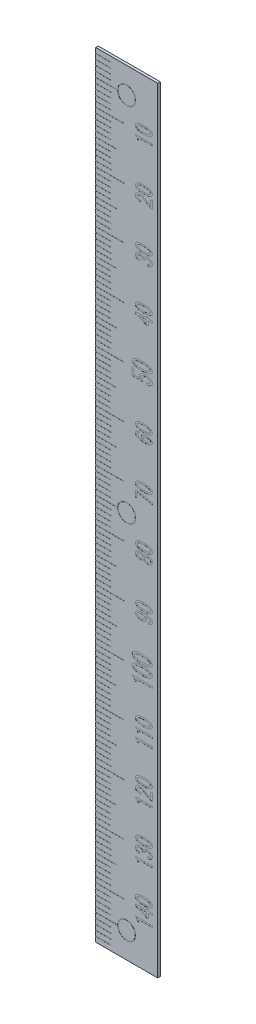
SolidWorks part; units mm, degrees
ref_plane "Front" through (0, 0, 0) normal (0, 0, 1) x (1, 0, 0)
ref_plane "Top" through (0, 0, 0) normal (0, 1, 0) x (1, 0, 0)
ref_plane "Right" through (0, 0, 0) normal (1, 0, 0) x (0, 0, -1)
sketch "Sketch1" plane through (0, 0, 0) normal (0, 0, 1) x (1, 0, 0)
  line L1 (0, 0) -> (0, 150)
  line L2 (0, 0) -> (12, 0)
  line L3 (12, 0) -> (12, 150)
  line L4 (0, 150) -> (12, 150)
  dimension "D1" = 150
  dimension "D2" = 12
extrude "Extrude1" add sketch "Sketch1" along normal blind 0.5
sketch "Sketch2" plane through (0, 0, 0.5) normal (0, 0, 1) x (1, 0, 0)
  line L0 (0, 150) -> (0, 0) construction
  line L1 (0, 0) -> (12, 0) construction
  line L2 (12, 150) -> (0, 150) construction
  circle A0 centre (6, 5) radius 1.75
  circle A1 centre (6, 145) radius 1.75
  circle A2 centre (6, 5) radius 1.65
  circle A3 centre (6, 145) radius 1.65
  circle A4 centre (6, 75) radius 1.75
  circle A5 centre (6, 75) radius 1.65
  dimension "D1" = 6
  dimension "D2" = 6
  dimension "D3" = 5
  dimension "D4" = 5
  dimension "D5" = 3.5
  dimension "D6" = 3.5
  dimension "D7" = 0.1
  dimension "D8" = 2
extrude "Extrude2" cut sketch "Sketch2" against normal blind 0.01
sketch "Sketch3" plane through (0, 0, 0.5) normal (0, 0, 1) x (1, 0, 0)
  line L0 (12, 150) -> (0, 150) construction
  line L1 (7.5, 138.25) -> (11, 138.25) construction
  line L2 (7.5, 138.25) -> (7.5, 141.75) construction
  line L3 (7.5, 141.75) -> (11, 141.75) construction
  line L4 (11, 138.25) -> (11, 141.75) construction
  line L6 (11, 128.25) -> (11, 131.75) construction
  line L7 (11, 118.25) -> (11, 121.75) construction
  line L8 (11, 108.25) -> (11, 111.75) construction
  line L9 (11, 98.25) -> (11, 101.75) construction
  line L10 (11, 88.25) -> (11, 91.75) construction
  line L11 (11, 78.25) -> (11, 81.75) construction
  line L12 (11, 68.25) -> (11, 71.75) construction
  line L13 (11, 58.25) -> (11, 61.75) construction
  line L14 (11, 47.2) -> (11, 52.8) construction
  line L15 (11, 37.2) -> (11, 42.8) construction
  line L16 (11, 48.25) -> (11, 51.75) construction
  line L17 (11, 50) -> (-4.9003, 50) construction
  line L18 (11, 27.2) -> (11, 32.8) construction
  line L19 (11, 17.2) -> (11, 22.8) construction
  line L20 (11, 7.2) -> (11, 12.8) construction
  line L21 (12, 0) -> (12, 150) construction
  text T0 "10" font "ＭＳ ゴシック" height in points 11
  text T1 "20" font "ＭＳ ゴシック" height in points 11
  text T2 "30" font "ＭＳ ゴシック" height in points 11
  text T3 "40" font "ＭＳ ゴシック" height in points 11
  text T4 "50" font "ＭＳ ゴシック" height in points 13
  text T5 "60  " font "ＭＳ ゴシック" height in points 11
  text T6 "70" font "ＭＳ ゴシック" height in points 11
  text T7 "80" font "ＭＳ ゴシック" height in points 11
  text T8 "90" font "ＭＳ ゴシック" height in points 11
  text T9 "100" font "ＭＳ ゴシック" height in points 13
  text T10 "110" font "ＭＳ ゴシック" height in points 11
  text T11 "120" font "ＭＳ ゴシック" height in points 11
  text T12 "130" font "ＭＳ ゴシック" height in points 11
  text T13 "140" font "ＭＳ ゴシック" height in points 11
  point P4 (11, 140)
  dimension "D1" = 3.5
  dimension "D2" = 10
  dimension "D3" = 1
  dimension "D4" = 3.5
  dimension "D8" = 5.6
  dimension "D9" = 1
  dimension "D5" = 4
  dimension "D6" = 7
  dimension "D7" = 5
extrude "Extrude3" cut sketch "Sketch3" against normal blind 0.01
sketch "Sketch4" plane through (0, 0, 0.5) normal (0, 0, 1) x (1, 0, 0)
  line L5 (12, 150) -> (0, 150) construction
  line L606 (6, 150) -> (6, 0) construction
  line L607 (0, 0) -> (12, 0) construction
  line L608 (3, 1.05) -> (3, 0.95)
  line L609 (0, 0.95) -> (3, 0.95)
  line L610 (0, 1.05) -> (3, 1.05)
  line L611 (0, 1.05) -> (0, 0.95)
  line L612 (3, 2.05) -> (3, 1.95)
  line L613 (0, 1.95) -> (3, 1.95)
  line L614 (0, 2.05) -> (3, 2.05)
  line L615 (0, 2.05) -> (0, 1.95)
  line L616 (3, 3.05) -> (3, 2.95)
  line L617 (0, 2.95) -> (3, 2.95)
  line L618 (0, 3.05) -> (3, 3.05)
  line L619 (0, 3.05) -> (0, 2.95)
  line L620 (3, 4.05) -> (3, 3.95)
  line L621 (0, 3.95) -> (3, 3.95)
  line L622 (0, 4.05) -> (3, 4.05)
  line L623 (0, 4.05) -> (0, 3.95)
  line L624 (3, 6.05) -> (3, 5.95)
  line L625 (0, 5.95) -> (3, 5.95)
  line L626 (0, 6.05) -> (3, 6.05)
  line L627 (0, 6.05) -> (0, 5.95)
  line L628 (3, 7.05) -> (3, 6.95)
  line L629 (0, 6.95) -> (3, 6.95)
  line L630 (0, 7.05) -> (3, 7.05)
  line L631 (0, 7.05) -> (0, 6.95)
  line L632 (3, 8.05) -> (3, 7.95)
  line L633 (0, 7.95) -> (3, 7.95)
  line L634 (0, 8.05) -> (3, 8.05)
  line L635 (3, 9.05) -> (3, 8.95)
  line L636 (0, 8.95) -> (3, 8.95)
  line L637 (0, 9.05) -> (0, 8.95)
  line L638 (0, 9.05) -> (3, 9.05)
  line L639 (4, 4.95) -> (4, 5.05)
  line L640 (0, 5.05) -> (4, 5.05)
  line L641 (0, 4.95) -> (0, 5.05)
  line L642 (0, 4.95) -> (4, 4.95)
  line L643 (0, 8.05) -> (0, 7.95)
  line L644 (0, 9.95) -> (0, 10.05)
  line L645 (5.5, 9.95) -> (0, 9.95)
  line L646 (5.5, 10.05) -> (5.5, 9.95)
  line L647 (0, 10.05) -> (5.5, 10.05)
  line L648 (3, 11.05) -> (3, 10.95)
  line L649 (0, 10.95) -> (3, 10.95)
  line L650 (0, 11.05) -> (3, 11.05)
  line L651 (0, 11.05) -> (0, 10.95)
  line L652 (3, 12.05) -> (3, 11.95)
  line L653 (0, 11.95) -> (3, 11.95)
  line L654 (0, 12.05) -> (3, 12.05)
  line L655 (0, 12.05) -> (0, 11.95)
  line L656 (3, 13.05) -> (3, 12.95)
  line L657 (0, 12.95) -> (3, 12.95)
  line L658 (0, 13.05) -> (3, 13.05)
  line L659 (0, 13.05) -> (0, 12.95)
  line L660 (3, 14.05) -> (3, 13.95)
  line L661 (0, 13.95) -> (3, 13.95)
  line L662 (0, 14.05) -> (3, 14.05)
  line L663 (0, 14.05) -> (0, 13.95)
  line L664 (3, 16.05) -> (3, 15.95)
  line L665 (0, 15.95) -> (3, 15.95)
  line L666 (0, 16.05) -> (3, 16.05)
  line L667 (0, 16.05) -> (0, 15.95)
  line L668 (3, 17.05) -> (3, 16.95)
  line L669 (0, 16.95) -> (3, 16.95)
  line L670 (0, 17.05) -> (3, 17.05)
  line L671 (0, 17.05) -> (0, 16.95)
  line L672 (3, 18.05) -> (3, 17.95)
  line L673 (0, 17.95) -> (3, 17.95)
  line L674 (0, 18.05) -> (3, 18.05)
  line L675 (3, 19.05) -> (3, 18.95)
  line L676 (0, 18.95) -> (3, 18.95)
  line L677 (0, 19.05) -> (0, 18.95)
  line L678 (0, 19.05) -> (3, 19.05)
  line L679 (4, 14.95) -> (4, 15.05)
  line L680 (0, 15.05) -> (4, 15.05)
  line L681 (0, 14.95) -> (0, 15.05)
  line L682 (0, 14.95) -> (4, 14.95)
  line L683 (0, 18.05) -> (0, 17.95)
  line L684 (0, 19.95) -> (0, 20.05)
  line L685 (5.5, 19.95) -> (0, 19.95)
  line L686 (5.5, 20.05) -> (5.5, 19.95)
  line L687 (0, 20.05) -> (5.5, 20.05)
  line L688 (3, 21.05) -> (3, 20.95)
  line L689 (0, 20.95) -> (3, 20.95)
  line L690 (0, 21.05) -> (3, 21.05)
  line L691 (0, 21.05) -> (0, 20.95)
  line L692 (3, 22.05) -> (3, 21.95)
  line L693 (0, 21.95) -> (3, 21.95)
  line L694 (0, 22.05) -> (3, 22.05)
  line L695 (0, 22.05) -> (0, 21.95)
  line L696 (3, 23.05) -> (3, 22.95)
  line L697 (0, 22.95) -> (3, 22.95)
  line L698 (0, 23.05) -> (3, 23.05)
  line L699 (0, 23.05) -> (0, 22.95)
  line L700 (3, 24.05) -> (3, 23.95)
  line L701 (0, 23.95) -> (3, 23.95)
  line L702 (0, 24.05) -> (3, 24.05)
  line L703 (0, 24.05) -> (0, 23.95)
  line L704 (3, 26.05) -> (3, 25.95)
  line L705 (0, 25.95) -> (3, 25.95)
  line L706 (0, 26.05) -> (3, 26.05)
  line L707 (0, 26.05) -> (0, 25.95)
  line L708 (3, 27.05) -> (3, 26.95)
  line L709 (0, 26.95) -> (3, 26.95)
  line L710 (0, 27.05) -> (3, 27.05)
  line L711 (0, 27.05) -> (0, 26.95)
  line L712 (3, 28.05) -> (3, 27.95)
  line L713 (0, 27.95) -> (3, 27.95)
  line L714 (0, 28.05) -> (3, 28.05)
  line L715 (3, 29.05) -> (3, 28.95)
  line L716 (0, 28.95) -> (3, 28.95)
  line L717 (0, 29.05) -> (0, 28.95)
  line L718 (0, 29.05) -> (3, 29.05)
  line L719 (4, 24.95) -> (4, 25.05)
  line L720 (0, 25.05) -> (4, 25.05)
  line L721 (0, 24.95) -> (0, 25.05)
  line L722 (0, 24.95) -> (4, 24.95)
  line L723 (0, 28.05) -> (0, 27.95)
  line L724 (0, 29.95) -> (0, 30.05)
  line L725 (5.5, 29.95) -> (0, 29.95)
  line L726 (5.5, 30.05) -> (5.5, 29.95)
  line L727 (0, 30.05) -> (5.5, 30.05)
  line L728 (3, 31.05) -> (3, 30.95)
  line L729 (0, 30.95) -> (3, 30.95)
  line L730 (0, 31.05) -> (3, 31.05)
  line L731 (0, 31.05) -> (0, 30.95)
  line L732 (3, 32.05) -> (3, 31.95)
  line L733 (0, 31.95) -> (3, 31.95)
  line L734 (0, 32.05) -> (3, 32.05)
  line L735 (0, 32.05) -> (0, 31.95)
  line L736 (3, 33.05) -> (3, 32.95)
  line L737 (0, 32.95) -> (3, 32.95)
  line L738 (0, 33.05) -> (3, 33.05)
  line L739 (0, 33.05) -> (0, 32.95)
  line L740 (3, 34.05) -> (3, 33.95)
  line L741 (0, 33.95) -> (3, 33.95)
  line L742 (0, 34.05) -> (3, 34.05)
  line L743 (0, 34.05) -> (0, 33.95)
  line L744 (3, 36.05) -> (3, 35.95)
  line L745 (0, 35.95) -> (3, 35.95)
  line L746 (0, 36.05) -> (3, 36.05)
  line L747 (0, 36.05) -> (0, 35.95)
  line L748 (3, 37.05) -> (3, 36.95)
  line L749 (0, 36.95) -> (3, 36.95)
  line L750 (0, 37.05) -> (3, 37.05)
  line L751 (0, 37.05) -> (0, 36.95)
  line L752 (3, 38.05) -> (3, 37.95)
  line L753 (0, 37.95) -> (3, 37.95)
  line L754 (0, 38.05) -> (3, 38.05)
  line L755 (3, 39.05) -> (3, 38.95)
  line L756 (0, 38.95) -> (3, 38.95)
  line L757 (0, 39.05) -> (0, 38.95)
  line L758 (0, 39.05) -> (3, 39.05)
  line L759 (4, 34.95) -> (4, 35.05)
  line L760 (0, 35.05) -> (4, 35.05)
  line L761 (0, 34.95) -> (0, 35.05)
  line L762 (0, 34.95) -> (4, 34.95)
  line L763 (0, 38.05) -> (0, 37.95)
  line L764 (0, 39.95) -> (0, 40.05)
  line L765 (5.5, 39.95) -> (0, 39.95)
  line L766 (5.5, 40.05) -> (5.5, 39.95)
  line L767 (0, 40.05) -> (5.5, 40.05)
  line L768 (3, 41.05) -> (3, 40.95)
  line L769 (0, 40.95) -> (3, 40.95)
  line L770 (0, 41.05) -> (3, 41.05)
  line L771 (0, 41.05) -> (0, 40.95)
  line L772 (3, 42.05) -> (3, 41.95)
  line L773 (0, 41.95) -> (3, 41.95)
  line L774 (0, 42.05) -> (3, 42.05)
  line L775 (0, 42.05) -> (0, 41.95)
  line L776 (3, 43.05) -> (3, 42.95)
  line L777 (0, 42.95) -> (3, 42.95)
  line L778 (0, 43.05) -> (3, 43.05)
  line L779 (0, 43.05) -> (0, 42.95)
  line L780 (3, 44.05) -> (3, 43.95)
  line L781 (0, 43.95) -> (3, 43.95)
  line L782 (0, 44.05) -> (3, 44.05)
  line L783 (0, 44.05) -> (0, 43.95)
  line L784 (3, 46.05) -> (3, 45.95)
  line L785 (0, 45.95) -> (3, 45.95)
  line L786 (0, 46.05) -> (3, 46.05)
  line L787 (0, 46.05) -> (0, 45.95)
  line L788 (3, 47.05) -> (3, 46.95)
  line L789 (0, 46.95) -> (3, 46.95)
  line L790 (0, 47.05) -> (3, 47.05)
  line L791 (0, 47.05) -> (0, 46.95)
  line L792 (3, 48.05) -> (3, 47.95)
  line L793 (0, 47.95) -> (3, 47.95)
  line L794 (0, 48.05) -> (3, 48.05)
  line L795 (3, 49.05) -> (3, 48.95)
  line L796 (0, 48.95) -> (3, 48.95)
  line L797 (0, 49.05) -> (0, 48.95)
  line L798 (0, 49.05) -> (3, 49.05)
  line L799 (4, 44.95) -> (4, 45.05)
  line L800 (0, 45.05) -> (4, 45.05)
  line L801 (0, 44.95) -> (0, 45.05)
  line L802 (0, 44.95) -> (4, 44.95)
  line L803 (0, 48.05) -> (0, 47.95)
  line L804 (0, 49.95) -> (0, 50.05)
  line L805 (5.5, 49.95) -> (0, 49.95)
  line L806 (5.5, 50.05) -> (5.5, 49.95)
  line L807 (0, 50.05) -> (5.5, 50.05)
  line L808 (3, 51.05) -> (3, 50.95)
  line L809 (0, 50.95) -> (3, 50.95)
  line L810 (0, 51.05) -> (3, 51.05)
  line L811 (0, 51.05) -> (0, 50.95)
  line L812 (3, 52.05) -> (3, 51.95)
  line L813 (0, 51.95) -> (3, 51.95)
  line L814 (0, 52.05) -> (3, 52.05)
  line L815 (0, 52.05) -> (0, 51.95)
  line L816 (3, 53.05) -> (3, 52.95)
  line L817 (0, 52.95) -> (3, 52.95)
  line L818 (0, 53.05) -> (3, 53.05)
  line L819 (0, 53.05) -> (0, 52.95)
  line L820 (3, 54.05) -> (3, 53.95)
  line L821 (0, 53.95) -> (3, 53.95)
  line L822 (0, 54.05) -> (3, 54.05)
  line L823 (0, 54.05) -> (0, 53.95)
  line L824 (3, 56.05) -> (3, 55.95)
  line L825 (0, 55.95) -> (3, 55.95)
  line L826 (0, 56.05) -> (3, 56.05)
  line L827 (0, 56.05) -> (0, 55.95)
  line L828 (3, 57.05) -> (3, 56.95)
  line L829 (0, 56.95) -> (3, 56.95)
  line L830 (0, 57.05) -> (3, 57.05)
  line L831 (0, 57.05) -> (0, 56.95)
  line L832 (3, 58.05) -> (3, 57.95)
  line L833 (0, 57.95) -> (3, 57.95)
  line L834 (0, 58.05) -> (3, 58.05)
  line L835 (3, 59.05) -> (3, 58.95)
  line L836 (0, 58.95) -> (3, 58.95)
  line L837 (0, 59.05) -> (0, 58.95)
  line L838 (0, 59.05) -> (3, 59.05)
  line L839 (4, 54.95) -> (4, 55.05)
  line L840 (0, 55.05) -> (4, 55.05)
  line L841 (0, 54.95) -> (0, 55.05)
  line L842 (0, 54.95) -> (4, 54.95)
  line L843 (0, 58.05) -> (0, 57.95)
  line L844 (0, 59.95) -> (0, 60.05)
  line L845 (5.5, 59.95) -> (0, 59.95)
  line L846 (5.5, 60.05) -> (5.5, 59.95)
  line L847 (0, 60.05) -> (5.5, 60.05)
  line L848 (3, 61.05) -> (3, 60.95)
  line L849 (0, 60.95) -> (3, 60.95)
  line L850 (0, 61.05) -> (3, 61.05)
  line L851 (0, 61.05) -> (0, 60.95)
  line L852 (3, 62.05) -> (3, 61.95)
  line L853 (0, 61.95) -> (3, 61.95)
  line L854 (0, 62.05) -> (3, 62.05)
  line L855 (0, 62.05) -> (0, 61.95)
  line L856 (3, 63.05) -> (3, 62.95)
  line L857 (0, 62.95) -> (3, 62.95)
  line L858 (0, 63.05) -> (3, 63.05)
  line L859 (0, 63.05) -> (0, 62.95)
  line L860 (3, 64.05) -> (3, 63.95)
  line L861 (0, 63.95) -> (3, 63.95)
  line L862 (0, 64.05) -> (3, 64.05)
  line L863 (0, 64.05) -> (0, 63.95)
  line L864 (3, 66.05) -> (3, 65.95)
  line L865 (0, 65.95) -> (3, 65.95)
  line L866 (0, 66.05) -> (3, 66.05)
  line L867 (0, 66.05) -> (0, 65.95)
  line L868 (3, 67.05) -> (3, 66.95)
  line L869 (0, 66.95) -> (3, 66.95)
  line L870 (0, 67.05) -> (3, 67.05)
  line L871 (0, 67.05) -> (0, 66.95)
  line L872 (3, 68.05) -> (3, 67.95)
  line L873 (0, 67.95) -> (3, 67.95)
  line L874 (0, 68.05) -> (3, 68.05)
  line L875 (3, 69.05) -> (3, 68.95)
  line L876 (0, 68.95) -> (3, 68.95)
  line L877 (0, 69.05) -> (0, 68.95)
  line L878 (0, 69.05) -> (3, 69.05)
  line L879 (4, 64.95) -> (4, 65.05)
  line L880 (0, 65.05) -> (4, 65.05)
  line L881 (0, 64.95) -> (0, 65.05)
  line L882 (0, 64.95) -> (4, 64.95)
  line L883 (0, 68.05) -> (0, 67.95)
  line L884 (0, 69.95) -> (0, 70.05)
  line L885 (5.5, 69.95) -> (0, 69.95)
  line L886 (5.5, 70.05) -> (5.5, 69.95)
  line L887 (0, 70.05) -> (5.5, 70.05)
  line L888 (3, 71.05) -> (3, 70.95)
  line L889 (0, 70.95) -> (3, 70.95)
  line L890 (0, 71.05) -> (3, 71.05)
  line L891 (0, 71.05) -> (0, 70.95)
  line L892 (3, 72.05) -> (3, 71.95)
  line L893 (0, 71.95) -> (3, 71.95)
  line L894 (0, 72.05) -> (3, 72.05)
  line L895 (0, 72.05) -> (0, 71.95)
  line L896 (3, 73.05) -> (3, 72.95)
  line L897 (0, 72.95) -> (3, 72.95)
  line L898 (0, 73.05) -> (3, 73.05)
  line L899 (0, 73.05) -> (0, 72.95)
  line L900 (3, 74.05) -> (3, 73.95)
  line L901 (0, 73.95) -> (3, 73.95)
  line L902 (0, 74.05) -> (3, 74.05)
  line L903 (0, 74.05) -> (0, 73.95)
  line L904 (3, 76.05) -> (3, 75.95)
  line L905 (0, 75.95) -> (3, 75.95)
  line L906 (0, 76.05) -> (3, 76.05)
  line L907 (0, 76.05) -> (0, 75.95)
  line L908 (3, 77.05) -> (3, 76.95)
  line L909 (0, 76.95) -> (3, 76.95)
  line L910 (0, 77.05) -> (3, 77.05)
  line L911 (0, 77.05) -> (0, 76.95)
  line L912 (3, 78.05) -> (3, 77.95)
  line L913 (0, 77.95) -> (3, 77.95)
  line L914 (0, 78.05) -> (3, 78.05)
  line L915 (3, 79.05) -> (3, 78.95)
  line L916 (0, 78.95) -> (3, 78.95)
  line L917 (0, 79.05) -> (0, 78.95)
  line L918 (0, 79.05) -> (3, 79.05)
  line L919 (4, 74.95) -> (4, 75.05)
  line L920 (0, 75.05) -> (4, 75.05)
  line L921 (0, 74.95) -> (0, 75.05)
  line L922 (0, 74.95) -> (4, 74.95)
  line L923 (0, 78.05) -> (0, 77.95)
  line L924 (0, 79.95) -> (0, 80.05)
  line L925 (5.5, 79.95) -> (0, 79.95)
  line L926 (5.5, 80.05) -> (5.5, 79.95)
  line L927 (0, 80.05) -> (5.5, 80.05)
  line L928 (3, 81.05) -> (3, 80.95)
  line L929 (0, 80.95) -> (3, 80.95)
  line L930 (0, 81.05) -> (3, 81.05)
  line L931 (0, 81.05) -> (0, 80.95)
  line L932 (3, 82.05) -> (3, 81.95)
  line L933 (0, 81.95) -> (3, 81.95)
  line L934 (0, 82.05) -> (3, 82.05)
  line L935 (0, 82.05) -> (0, 81.95)
  line L936 (3, 83.05) -> (3, 82.95)
  line L937 (0, 82.95) -> (3, 82.95)
  line L938 (0, 83.05) -> (3, 83.05)
  line L939 (0, 83.05) -> (0, 82.95)
  line L940 (3, 84.05) -> (3, 83.95)
  line L941 (0, 83.95) -> (3, 83.95)
  line L942 (0, 84.05) -> (3, 84.05)
  line L943 (0, 84.05) -> (0, 83.95)
  line L944 (3, 86.05) -> (3, 85.95)
  line L945 (0, 85.95) -> (3, 85.95)
  line L946 (0, 86.05) -> (3, 86.05)
  line L947 (0, 86.05) -> (0, 85.95)
  line L948 (3, 87.05) -> (3, 86.95)
  line L949 (0, 86.95) -> (3, 86.95)
  line L950 (0, 87.05) -> (3, 87.05)
  line L951 (0, 87.05) -> (0, 86.95)
  line L952 (3, 88.05) -> (3, 87.95)
  line L953 (0, 87.95) -> (3, 87.95)
  line L954 (0, 88.05) -> (3, 88.05)
  line L955 (3, 89.05) -> (3, 88.95)
  line L956 (0, 88.95) -> (3, 88.95)
  line L957 (0, 89.05) -> (0, 88.95)
  line L958 (0, 89.05) -> (3, 89.05)
  line L959 (4, 84.95) -> (4, 85.05)
  line L960 (0, 85.05) -> (4, 85.05)
  line L961 (0, 84.95) -> (0, 85.05)
  line L962 (0, 84.95) -> (4, 84.95)
  line L963 (0, 88.05) -> (0, 87.95)
  line L964 (0, 89.95) -> (0, 90.05)
  line L965 (5.5, 89.95) -> (0, 89.95)
  line L966 (5.5, 90.05) -> (5.5, 89.95)
  line L967 (0, 90.05) -> (5.5, 90.05)
  line L968 (3, 91.05) -> (3, 90.95)
  line L969 (0, 90.95) -> (3, 90.95)
  line L970 (0, 91.05) -> (3, 91.05)
  line L971 (0, 91.05) -> (0, 90.95)
  line L972 (3, 92.05) -> (3, 91.95)
  line L973 (0, 91.95) -> (3, 91.95)
  line L974 (0, 92.05) -> (3, 92.05)
  line L975 (0, 92.05) -> (0, 91.95)
  line L976 (3, 93.05) -> (3, 92.95)
  line L977 (0, 92.95) -> (3, 92.95)
  line L978 (0, 93.05) -> (3, 93.05)
  line L979 (0, 93.05) -> (0, 92.95)
  line L980 (3, 94.05) -> (3, 93.95)
  line L981 (0, 93.95) -> (3, 93.95)
  line L982 (0, 94.05) -> (3, 94.05)
  line L983 (0, 94.05) -> (0, 93.95)
  line L984 (3, 96.05) -> (3, 95.95)
  line L985 (0, 95.95) -> (3, 95.95)
  line L986 (0, 96.05) -> (3, 96.05)
  line L987 (0, 96.05) -> (0, 95.95)
  line L988 (3, 97.05) -> (3, 96.95)
  line L989 (0, 96.95) -> (3, 96.95)
  line L990 (0, 97.05) -> (3, 97.05)
  line L991 (0, 97.05) -> (0, 96.95)
  line L992 (3, 98.05) -> (3, 97.95)
  line L993 (0, 97.95) -> (3, 97.95)
  line L994 (0, 98.05) -> (3, 98.05)
  line L995 (3, 99.05) -> (3, 98.95)
  line L996 (0, 98.95) -> (3, 98.95)
  line L997 (0, 99.05) -> (0, 98.95)
  line L998 (0, 99.05) -> (3, 99.05)
  line L999 (4, 94.95) -> (4, 95.05)
  line L1000 (0, 95.05) -> (4, 95.05)
  line L1001 (0, 94.95) -> (0, 95.05)
  line L1002 (0, 94.95) -> (4, 94.95)
  line L1003 (0, 98.05) -> (0, 97.95)
  line L1004 (3, 101.05) -> (3, 100.95)
  line L1005 (0, 100.95) -> (3, 100.95)
  line L1006 (0, 101.05) -> (3, 101.05)
  line L1007 (0, 101.05) -> (0, 100.95)
  line L1008 (3, 102.05) -> (3, 101.95)
  line L1009 (0, 101.95) -> (3, 101.95)
  line L1010 (0, 102.05) -> (3, 102.05)
  line L1011 (0, 102.05) -> (0, 101.95)
  line L1012 (3, 103.05) -> (3, 102.95)
  line L1013 (0, 102.95) -> (3, 102.95)
  line L1014 (0, 103.05) -> (3, 103.05)
  line L1015 (0, 103.05) -> (0, 102.95)
  line L1016 (3, 104.05) -> (3, 103.95)
  line L1017 (0, 103.95) -> (3, 103.95)
  line L1018 (0, 104.05) -> (3, 104.05)
  line L1019 (0, 104.05) -> (0, 103.95)
  line L1020 (3, 106.05) -> (3, 105.95)
  line L1021 (0, 105.95) -> (3, 105.95)
  line L1022 (0, 106.05) -> (3, 106.05)
  line L1023 (0, 106.05) -> (0, 105.95)
  line L1024 (3, 107.05) -> (3, 106.95)
  line L1025 (0, 106.95) -> (3, 106.95)
  line L1026 (0, 107.05) -> (3, 107.05)
  line L1027 (0, 107.05) -> (0, 106.95)
  line L1028 (3, 108.05) -> (3, 107.95)
  line L1029 (0, 107.95) -> (3, 107.95)
  line L1030 (0, 108.05) -> (3, 108.05)
  line L1031 (3, 109.05) -> (3, 108.95)
  line L1032 (0, 108.95) -> (3, 108.95)
  line L1033 (0, 109.05) -> (0, 108.95)
  line L1034 (0, 109.05) -> (3, 109.05)
  line L1035 (4, 104.95) -> (4, 105.05)
  line L1036 (0, 105.05) -> (4, 105.05)
  line L1037 (0, 104.95) -> (0, 105.05)
  line L1038 (0, 104.95) -> (4, 104.95)
  line L1039 (0, 108.05) -> (0, 107.95)
  line L1040 (0, 99.95) -> (0, 100.05)
  line L1041 (5.5, 99.95) -> (0, 99.95)
  line L1042 (5.5, 100.05) -> (5.5, 99.95)
  line L1043 (0, 100.05) -> (5.5, 100.05)
  line L1044 (3, 111.05) -> (3, 110.95)
  line L1045 (0, 110.95) -> (3, 110.95)
  line L1046 (0, 111.05) -> (3, 111.05)
  line L1047 (0, 111.05) -> (0, 110.95)
  line L1048 (3, 112.05) -> (3, 111.95)
  line L1049 (0, 111.95) -> (3, 111.95)
  line L1050 (0, 112.05) -> (3, 112.05)
  line L1051 (0, 112.05) -> (0, 111.95)
  line L1052 (3, 113.05) -> (3, 112.95)
  line L1053 (0, 112.95) -> (3, 112.95)
  line L1054 (0, 113.05) -> (3, 113.05)
  line L1055 (0, 113.05) -> (0, 112.95)
  line L1056 (3, 114.05) -> (3, 113.95)
  line L1057 (0, 113.95) -> (3, 113.95)
  line L1058 (0, 114.05) -> (3, 114.05)
  line L1059 (0, 114.05) -> (0, 113.95)
  line L1060 (3, 116.05) -> (3, 115.95)
  line L1061 (0, 115.95) -> (3, 115.95)
  line L1062 (0, 116.05) -> (3, 116.05)
  line L1063 (0, 116.05) -> (0, 115.95)
  line L1064 (3, 117.05) -> (3, 116.95)
  line L1065 (0, 116.95) -> (3, 116.95)
  line L1066 (0, 117.05) -> (3, 117.05)
  line L1067 (0, 117.05) -> (0, 116.95)
  line L1068 (3, 118.05) -> (3, 117.95)
  line L1069 (0, 117.95) -> (3, 117.95)
  line L1070 (0, 118.05) -> (3, 118.05)
  line L1071 (3, 119.05) -> (3, 118.95)
  line L1072 (0, 118.95) -> (3, 118.95)
  line L1073 (0, 119.05) -> (0, 118.95)
  line L1074 (0, 119.05) -> (3, 119.05)
  line L1075 (4, 114.95) -> (4, 115.05)
  line L1076 (0, 115.05) -> (4, 115.05)
  line L1077 (0, 114.95) -> (0, 115.05)
  line L1078 (0, 114.95) -> (4, 114.95)
  line L1079 (0, 118.05) -> (0, 117.95)
  line L1080 (0, 109.95) -> (0, 110.05)
  line L1081 (5.5, 109.95) -> (0, 109.95)
  line L1082 (5.5, 110.05) -> (5.5, 109.95)
  line L1083 (0, 110.05) -> (5.5, 110.05)
  line L1084 (3, 121.05) -> (3, 120.95)
  line L1085 (0, 120.95) -> (3, 120.95)
  line L1086 (0, 121.05) -> (3, 121.05)
  line L1087 (0, 121.05) -> (0, 120.95)
  line L1088 (3, 122.05) -> (3, 121.95)
  line L1089 (0, 121.95) -> (3, 121.95)
  line L1090 (0, 122.05) -> (3, 122.05)
  line L1091 (0, 122.05) -> (0, 121.95)
  line L1092 (3, 123.05) -> (3, 122.95)
  line L1093 (0, 122.95) -> (3, 122.95)
  line L1094 (0, 123.05) -> (3, 123.05)
  line L1095 (0, 123.05) -> (0, 122.95)
  line L1096 (3, 124.05) -> (3, 123.95)
  line L1097 (0, 123.95) -> (3, 123.95)
  line L1098 (0, 124.05) -> (3, 124.05)
  line L1099 (0, 124.05) -> (0, 123.95)
  line L1100 (3, 126.05) -> (3, 125.95)
  line L1101 (0, 125.95) -> (3, 125.95)
  line L1102 (0, 126.05) -> (3, 126.05)
  line L1103 (0, 126.05) -> (0, 125.95)
  line L1104 (3, 127.05) -> (3, 126.95)
  line L1105 (0, 126.95) -> (3, 126.95)
  line L1106 (0, 127.05) -> (3, 127.05)
  line L1107 (0, 127.05) -> (0, 126.95)
  line L1108 (3, 128.05) -> (3, 127.95)
  line L1109 (0, 127.95) -> (3, 127.95)
  line L1110 (0, 128.05) -> (3, 128.05)
  line L1111 (3, 129.05) -> (3, 128.95)
  line L1112 (0, 128.95) -> (3, 128.95)
  line L1113 (0, 129.05) -> (0, 128.95)
  line L1114 (0, 129.05) -> (3, 129.05)
  line L1115 (4, 124.95) -> (4, 125.05)
  line L1116 (0, 125.05) -> (4, 125.05)
  line L1117 (0, 124.95) -> (0, 125.05)
  line L1118 (0, 124.95) -> (4, 124.95)
  line L1119 (0, 128.05) -> (0, 127.95)
  line L1120 (0, 119.95) -> (0, 120.05)
  line L1121 (5.5, 119.95) -> (0, 119.95)
  line L1122 (5.5, 120.05) -> (5.5, 119.95)
  line L1123 (0, 120.05) -> (5.5, 120.05)
  line L1124 (3, 131.05) -> (3, 130.95)
  line L1125 (0, 130.95) -> (3, 130.95)
  line L1126 (0, 131.05) -> (3, 131.05)
  line L1127 (0, 131.05) -> (0, 130.95)
  line L1128 (3, 132.05) -> (3, 131.95)
  line L1129 (0, 131.95) -> (3, 131.95)
  line L1130 (0, 132.05) -> (3, 132.05)
  line L1131 (0, 132.05) -> (0, 131.95)
  line L1132 (3, 133.05) -> (3, 132.95)
  line L1133 (0, 132.95) -> (3, 132.95)
  line L1134 (0, 133.05) -> (3, 133.05)
  line L1135 (0, 133.05) -> (0, 132.95)
  line L1136 (3, 134.05) -> (3, 133.95)
  line L1137 (0, 133.95) -> (3, 133.95)
  line L1138 (0, 134.05) -> (3, 134.05)
  line L1139 (0, 134.05) -> (0, 133.95)
  line L1140 (3, 136.05) -> (3, 135.95)
  line L1141 (0, 135.95) -> (3, 135.95)
  line L1142 (0, 136.05) -> (3, 136.05)
  line L1143 (0, 136.05) -> (0, 135.95)
  line L1144 (3, 137.05) -> (3, 136.95)
  line L1145 (0, 136.95) -> (3, 136.95)
  line L1146 (0, 137.05) -> (3, 137.05)
  line L1147 (0, 137.05) -> (0, 136.95)
  line L1148 (3, 138.05) -> (3, 137.95)
  line L1149 (0, 137.95) -> (3, 137.95)
  line L1150 (0, 138.05) -> (3, 138.05)
  line L1151 (3, 139.05) -> (3, 138.95)
  line L1152 (0, 138.95) -> (3, 138.95)
  line L1153 (0, 139.05) -> (0, 138.95)
  line L1154 (0, 139.05) -> (3, 139.05)
  line L1155 (4, 134.95) -> (4, 135.05)
  line L1156 (0, 135.05) -> (4, 135.05)
  line L1157 (0, 134.95) -> (0, 135.05)
  line L1158 (0, 134.95) -> (4, 134.95)
  line L1159 (0, 138.05) -> (0, 137.95)
  line L1160 (3, 141.05) -> (3, 140.95)
  line L1161 (0, 140.95) -> (3, 140.95)
  line L1162 (0, 141.05) -> (3, 141.05)
  line L1163 (0, 141.05) -> (0, 140.95)
  line L1164 (3, 142.05) -> (3, 141.95)
  line L1165 (0, 141.95) -> (3, 141.95)
  line L1166 (0, 142.05) -> (3, 142.05)
  line L1167 (0, 142.05) -> (0, 141.95)
  line L1168 (3, 143.05) -> (3, 142.95)
  line L1169 (0, 142.95) -> (3, 142.95)
  line L1170 (0, 143.05) -> (3, 143.05)
  line L1171 (0, 143.05) -> (0, 142.95)
  line L1172 (3, 144.05) -> (3, 143.95)
  line L1173 (0, 143.95) -> (3, 143.95)
  line L1174 (0, 144.05) -> (3, 144.05)
  line L1175 (0, 144.05) -> (0, 143.95)
  line L1176 (0, 129.95) -> (0, 130.05)
  line L1177 (5.5, 129.95) -> (0, 129.95)
  line L1178 (5.5, 130.05) -> (5.5, 129.95)
  line L1179 (0, 130.05) -> (5.5, 130.05)
  line L1180 (3, 146.05) -> (3, 145.95)
  line L1181 (0, 145.95) -> (3, 145.95)
  line L1182 (0, 146.05) -> (3, 146.05)
  line L1183 (0, 146.05) -> (0, 145.95)
  line L1184 (3, 147.05) -> (3, 146.95)
  line L1185 (0, 146.95) -> (3, 146.95)
  line L1186 (0, 147.05) -> (3, 147.05)
  line L1187 (0, 147.05) -> (0, 146.95)
  line L1188 (3, 148.05) -> (3, 147.95)
  line L1189 (0, 147.95) -> (3, 147.95)
  line L1190 (0, 148.05) -> (3, 148.05)
  line L1191 (3, 149.05) -> (3, 148.95)
  line L1192 (0, 148.95) -> (3, 148.95)
  line L1193 (0, 149.05) -> (0, 148.95)
  line L1194 (0, 149.05) -> (3, 149.05)
  line L1195 (4, 144.95) -> (4, 145.05)
  line L1196 (0, 145.05) -> (4, 145.05)
  line L1197 (0, 144.95) -> (0, 145.05)
  line L1198 (0, 144.95) -> (4, 144.95)
  line L1199 (0, 148.05) -> (0, 147.95)
  line L1200 (0, 139.95) -> (0, 140.05)
  line L1201 (5.5, 139.95) -> (0, 139.95)
  line L1202 (5.5, 140.05) -> (5.5, 139.95)
  line L1203 (0, 140.05) -> (5.5, 140.05)
extrude "Extrude4" cut sketch "Sketch4" against normal blind 0.01
move or copy body "Body-Move/Copy2" bodies to move or copy 105 copy no translate (-12, -150, 0)
